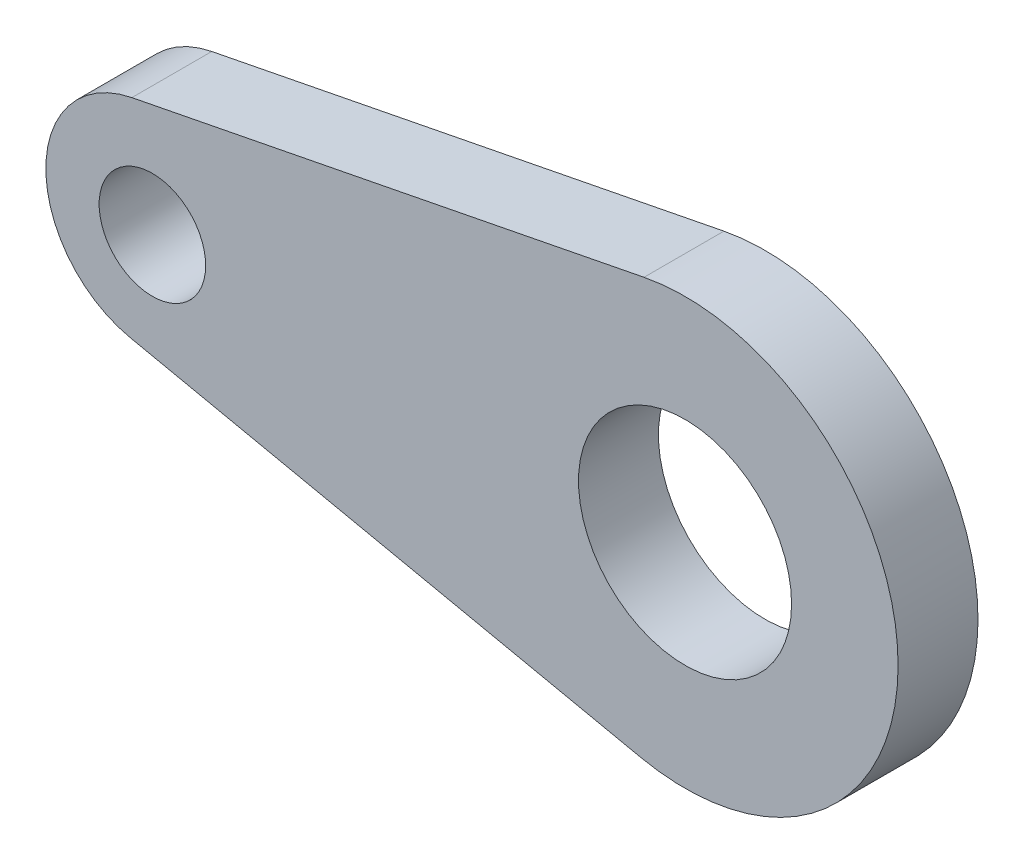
SolidWorks part; units mm, degrees
ref_plane "Plano frontal" through (0, 0, 0) normal (0, 0, 1) x (1, 0, 0)
ref_plane "Plano superior" through (0, 0, 0) normal (0, 1, 0) x (1, 0, 0)
ref_plane "Plano direito" through (0, 0, 0) normal (1, 0, 0) x (0, 0, -1)
sketch "Esboço1" plane through (0, 0, 0) normal (0, 0, 1) x (1, 0, 0)
  line L0 (-4.1492, -18.8024) -> (91.7016, -39.1297)
  line L3 (-3.9944, 20.3601) -> (92.2993, 39.2517)
  arc A0 (-3.8503, 20.3884) -> (-4.1492, -18.8024) centre (0, 0.7625) ccw
  arc A2 (91.7016, -39.1297) -> (92.2993, 39.2517) centre (100, 0) ccw
  circle A3 centre (0, 0) radius 10
  circle A4 centre (100, 0) radius 20
  dimension "D2" = 40
  dimension "D3" = 80
  dimension "D4" = 20
  dimension "D5" = 40
  dimension "D1" = 100
extrude "Ressalto-extrusão3" add sketch "Esboço1" along normal blind 15 contours L0 A2 L3 A0 A4 A3
